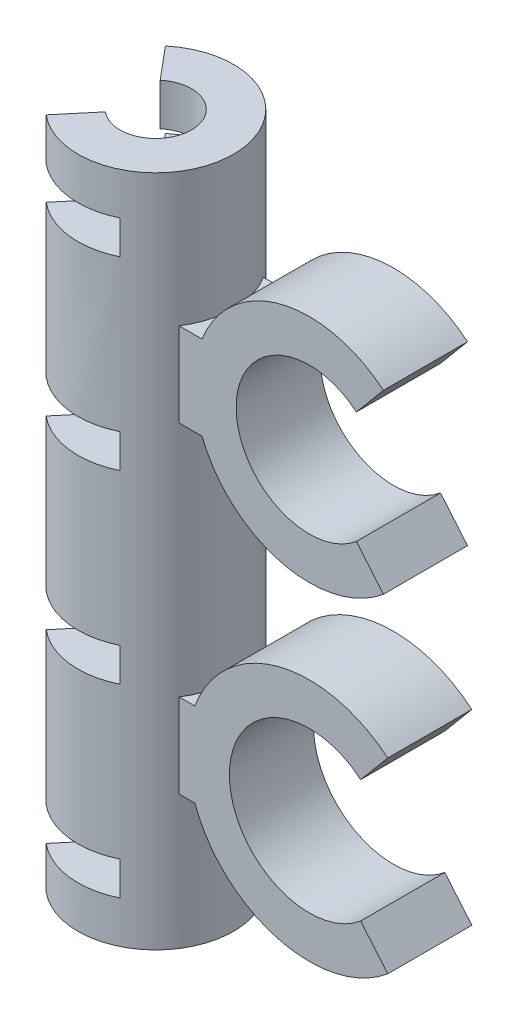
SolidWorks part; units mm, degrees
ref_plane "Front Plane" through (0, 0, 0) normal (0, 0, 1) x (1, 0, 0)
ref_plane "Top Plane" through (0, 0, 0) normal (0, 1, 0) x (1, 0, 0)
ref_plane "Right Plane" through (0, 0, 0) normal (1, 0, 0) x (0, 0, -1)
sketch "Sketch1" plane through (0, 0, 0) normal (0, 1, 0) x (1, 0, 0)
  line L0 (-2.7318, 3.2557) -> (-5.9458, 7.0859)
  line L1 (-5.9458, -7.0859) -> (-2.7318, -3.2557)
  line L2 (0, 7.2069) -> (0, -7.5067) construction
  line L3 (0, -2.2) -> (0, 2.2) construction
  circle A0 centre (0, 0) radius 4.05 construction
  arc A1 (-2.7318, -3.2557) -> (-2.7318, 3.2557) centre (0, 0) ccw
  arc A2 (-5.9458, -7.0859) -> (-5.9458, 7.0859) centre (0, 0) ccw
  point P11 (0, 0)
  dimension "D1" = 8.1
  dimension "D2" = 0.2
  dimension "D3" = 5
  dimension "D4" = 100
  dimension "D5" = 40
extrude "Boss-Extrude1" add sketch "Sketch1" along normal mid plane 80
sketch "Sketch2" plane through (0, 0, 0) normal (0, 0, 1) x (1, 0, 0)
  line L0 (32.0562, 29.5948) -> (28.8423, 25.7646)
  line L1 (32.0562, 8.6052) -> (28.8423, 12.4354)
  line L2 (23.25, 19.1) -> (23.25, -19.1) construction
  line L3 (23.25, -4.6) -> (23.25, 5.4) construction
  line L4 (-5.9458, 0) -> (43.9473, 0) construction
  line L5 (32.5704, -30.2076) -> (29.3565, -26.3774)
  line L6 (32.5704, -7.9924) -> (29.3565, -11.8226)
  line L7 (23.25, -19.1) -> (23.25, -41.5115) construction
  line L8 (-5.9458, 40) -> (-5.9458, -40) construction
  line L9 (5.5, 0) -> (-5.5, 0) construction
  line L10 (4.25, 24.1) -> (10.495, 24.1)
  line L11 (4.25, 14.1) -> (10.495, 14.1)
  line L12 (23.25, 19.1) -> (-9.0431, 19.1) construction
  line L13 (4.25, 14.1) -> (4.25, 24.1)
  line L14 (4.25, -14.1) -> (9.6393, -14.1)
  line L15 (4.25, -24.1) -> (9.6393, -24.1)
  line L16 (23.25, -19.1) -> (-12.5685, -19.1) construction
  line L17 (4.25, -14.1) -> (4.25, -24.1)
  line L20 (4.25, 40) -> (4.25, -54.2294) construction
  circle A0 centre (23.25, 19.1) radius 8.5 construction
  arc A1 (28.8423, 25.7646) -> (28.8423, 12.4354) centre (23.25, 19.1) ccw
  arc A2 (32.0562, 29.5948) -> (32.0562, 8.6052) centre (23.25, 19.1) ccw
  arc A4 (29.3565, -11.8226) -> (29.3565, -26.3774) centre (23.25, -19.1) ccw
  arc A5 (32.5704, -7.9924) -> (32.5704, -30.2076) centre (23.25, -19.1) ccw
  point P10 (23.25, 0)
  point P31 (4.25, -19.1)
  point P33 (4.25, 19.1)
  point P36 (0, 0)
  point P37 (0, 0)
  point P38 (8.75, -19.1)
  point P39 (0, 0)
  point P41 (0, 0)
  dimension "D1" = 17
  dimension "D2" = 0.2
  dimension "D3" = 5
  dimension "D6" = 9.5
  dimension "D7" = 5
  dimension "D8" = 10
  dimension "D4" = 100
  dimension "D5" = 40
  dimension "D9" = 10
  dimension "D10" = 100
  dimension "D11" = 40
  dimension "D12" = 4.5
  dimension "D13" = 10
extrude "Boss-Extrude2" add sketch "Sketch2" along normal mid plane 10 contours A2 L10 L13 L11 | L0 A2 L1 A1 | A5 L14 L17 L15 | L6 A5 L5 A4
sketch "Sketch5" plane through (0, 0, 0) normal (0, 0, 1) x (1, 0, 0)
  line L0 (-5.9458, 35) -> (4.0542, 35)
  line L1 (-5.9458, 40) -> (-5.9458, -40) construction
  line L2 (4.0542, 35) -> (4.0542, 31)
  line L3 (4.0542, 31) -> (-5.9458, 31)
  line L4 (9.25, 40) -> (-5.9458, 40) construction
  line L5 (-5.9458, -9) -> (4.0542, -9)
  line L6 (-5.9458, 13) -> (4.0542, 13)
  line L7 (4.0542, 13) -> (4.0542, 9)
  line L8 (4.0542, 9) -> (-5.9458, 9)
  line L9 (4.0542, -9) -> (4.0542, -13)
  line L10 (4.0542, -13) -> (-5.9458, -13)
  line L11 (-5.9458, -31) -> (4.0542, -31)
  line L12 (4.0542, -31) -> (4.0542, -35)
  line L13 (4.0542, -35) -> (-5.9458, -35)
  line L15 (-5.9458, 35) -> (-5.9458, 31)
  line L16 (-5.9458, 13) -> (-5.9458, 9)
  line L17 (-5.9458, -9) -> (-5.9458, -13)
  line L18 (-5.9458, -31) -> (-5.9458, -35)
  dimension "D1" = 5
  dimension "D2" = 10
  dimension "D3" = 4
  dimension "D4" = 18
  dimension "D5" = 18
  dimension "D6" = 18
extrude "Cut-Extrude1" cut sketch "Sketch5" against normal through all both and the other way through all contours L0 L15 L3 L2 | L6 L16 L8 L7 | L5 L17 L10 L9 | L11 L18 L13 L12
